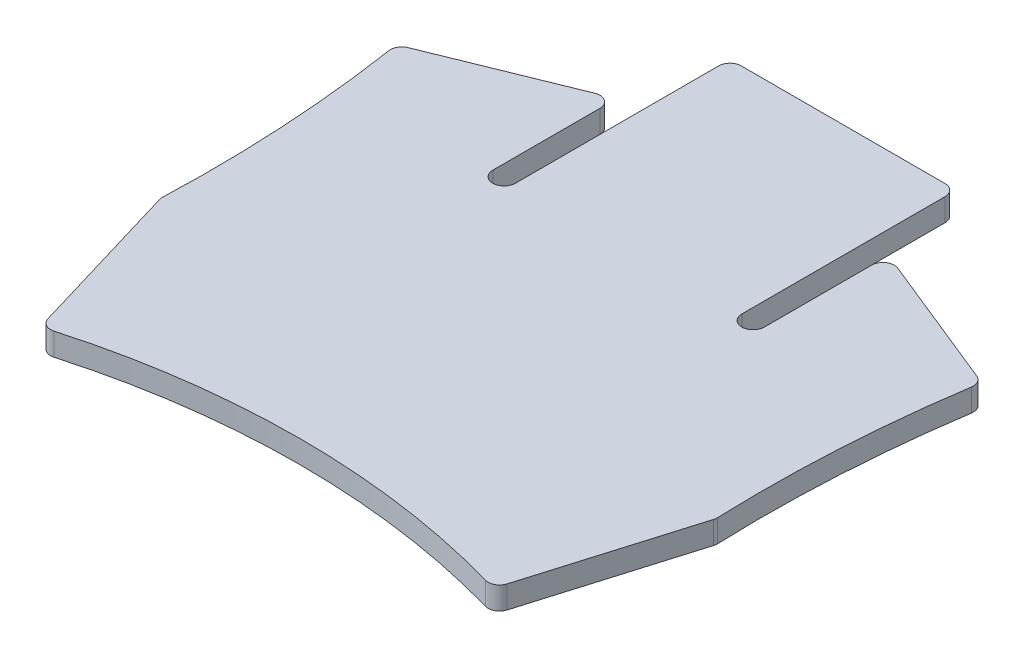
SolidWorks part; units mm, degrees
ref_plane "Plano frontal" through (0, 0, 0) normal (0, 0, 1) x (1, 0, 0)
ref_plane "Plano superior" through (0, 0, 0) normal (0, 1, 0) x (1, 0, 0)
ref_plane "Plano direito" through (0, 0, 0) normal (1, 0, 0) x (0, 0, -1)
sketch "Esboço1" plane through (0, 0, 0) normal (0, 1, 0) x (1, 0, 0)
  line L0 (9, 21.448) -> (-9, 21.448)
  line L1 (-10, 20.448) -> (-10, 2.4935)
  line L2 (-12, 2.4935) -> (-12, 11.9636)
  line L3 (-13.3757, 12.8903) -> (-25.1183, 8.1301)
  line L4 (-24.4721, -14.47) -> (-20.2837, -28.5184)
  line L5 (0, 21.448) -> (0, -26.552) construction
  line L6 (24.4721, -14.47) -> (20.2837, -28.5184)
  line L7 (13.3757, 12.8903) -> (25.1183, 8.1301)
  line L8 (12, 2.4935) -> (12, 11.9636)
  line L9 (10, 20.448) -> (10, 2.4935)
  arc A0 (-10, 2.4935) -> (-12, 2.4935) centre (-11, 2.4935) cw
  arc A1 (-24.5131, -14.1476) -> (-25.7312, 7.0525) centre (-137.421, -9.9998) ccw
  arc A2 (-19.0532, -29.195) -> (0, -26.552) centre (0, -96.552) cw
  arc A3 (-20.2837, -28.5184) -> (-19.0532, -29.195) centre (-19.3254, -28.2327) ccw
  arc A4 (-24.4721, -14.47) -> (-24.5131, -14.1476) centre (-23.5138, -14.1843) cw
  arc A5 (-25.1183, 8.1301) -> (-25.7312, 7.0525) centre (-24.7427, 7.2034) ccw
  arc A6 (-12, 11.9636) -> (-13.3757, 12.8903) centre (-13, 11.9636) ccw
  arc A7 (-9, 21.448) -> (-10, 20.448) centre (-9, 20.448) ccw
  arc A8 (9, 21.448) -> (10, 20.448) centre (9, 20.448) cw
  arc A9 (12, 11.9636) -> (13.3757, 12.8903) centre (13, 11.9636) cw
  arc A10 (25.1183, 8.1301) -> (25.7312, 7.0525) centre (24.7427, 7.2034) cw
  arc A11 (24.4721, -14.47) -> (24.5131, -14.1476) centre (23.5138, -14.1843) ccw
  arc A12 (20.2837, -28.5184) -> (19.0532, -29.195) centre (19.3254, -28.2327) cw
  arc A13 (19.0532, -29.195) -> (0, -26.552) centre (0, -96.552) ccw
  arc A14 (24.5131, -14.1476) -> (25.7312, 7.0525) centre (137.421, -9.9998) cw
  arc A15 (10, 2.4935) -> (12, 2.4935) centre (11, 2.4935) ccw
  point P14 (-20, -29.47)
  point P18 (-26, -14.47)
  point P21 (-26, 7.7727)
  point P24 (-12, 13.448)
  point P47 (12, 13.448)
  point P48 (26, 7.7727)
  point P49 (26, -14.47)
  point P50 (20, -29.47)
  dimension "D9" = 1
  dimension "D10" = 70
  dimension "D1" = 20
  dimension "D2" = 2
  dimension "D3" = 12
  dimension "D4" = 52
  dimension "D5" = 40
  dimension "D6" = 15
  dimension "D7" = 48
  dimension "D8" = 40
  dimension "D11" = 15
extrude "Ressalto-extrusão1" add sketch "Esboço1" along normal blind 2
